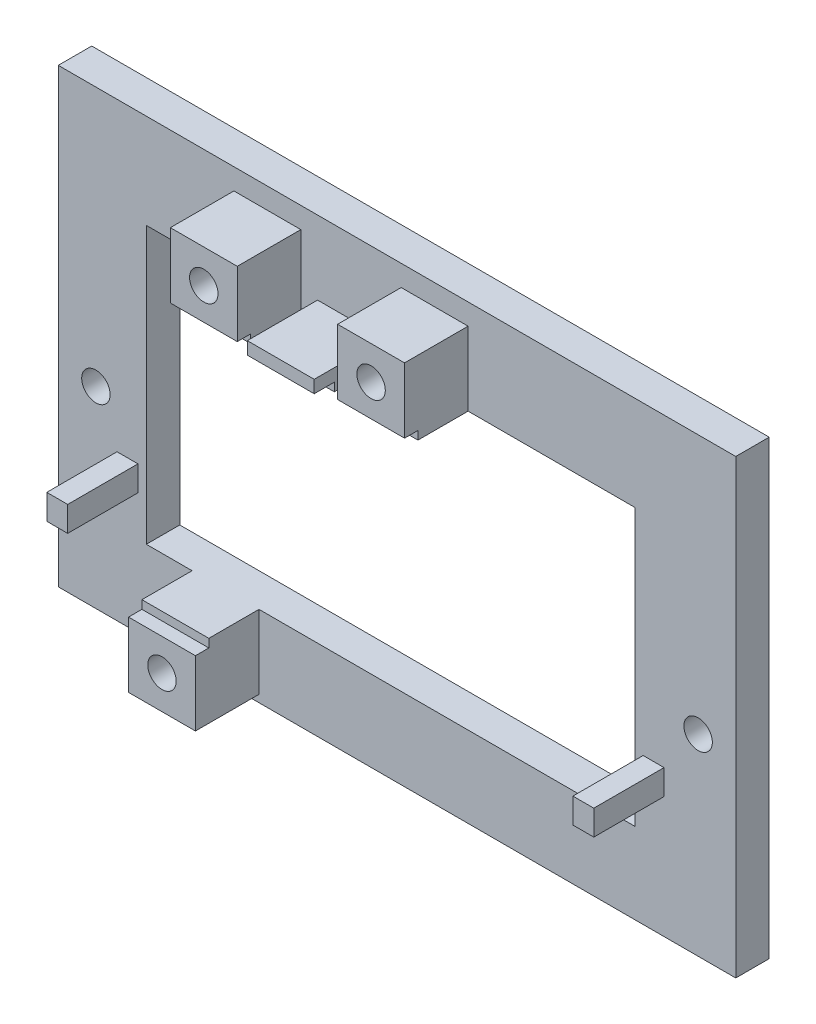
SolidWorks part; units mm, degrees
ref_plane "前视基准面" through (0, 0, 0) normal (0, 0, 1) x (1, 0, 0)
ref_plane "上视基准面" through (0, 0, 0) normal (0, 1, 0) x (1, 0, 0)
ref_plane "右视基准面" through (0, 0, 0) normal (1, 0, 0) x (0, 0, -1)
other "Configuration Table"
sketch "草图1" plane through (0, 0, 0) normal (0, 0, 1) x (1, 0, 0)
  line L0 (-35, -19) -> (46, -19)
  line L1 (46, -19) -> (46, 35)
  line L2 (46, 35) -> (-35, 35)
  line L3 (-35, 35) -> (-35, -19)
  line L4 (-24.473, -9.328) -> (33.927, -9.328)
  line L5 (33.927, -9.328) -> (33.927, 23.691)
  line L6 (33.927, 23.691) -> (-24.473, 23.691)
  line L7 (-24.473, 23.691) -> (-24.473, -9.328)
  circle A0 centre (-30.5, 4) radius 1.7
  circle A1 centre (41.5, 4) radius 1.7
  circle A2 centre (-10, 28.491) radius 1.7
  circle A3 centre (10, 28.491) radius 1.7
  circle A4 centre (-15, -14.128) radius 1.7
  dimension "D1" = 3.4
  dimension "D2" = 10
  dimension "D3" = 33.927
  dimension "D4" = 41.5
  dimension "D5" = 46
  dimension "D6" = 10
  dimension "D7" = 15
  dimension "D8" = 24.473
  dimension "D9" = 30.5
  dimension "D10" = 35
  dimension "D11" = 4
  dimension "D12" = 23.691
  dimension "D13" = 28.491
  dimension "D14" = 35
  dimension "D15" = 9.328
  dimension "D16" = 14.128
  dimension "D17" = 19
extrude "Open_back_tray_and_M3_holes" add sketch "草图1" along normal blind 4
sketch "草图2" plane through (0, 0, 0) normal (0, 0, 1) x (1, 0, 0)
  line L0 (-14, 23.691) -> (-6, 23.691)
  line L1 (-6, 23.691) -> (-6, 32.491)
  line L2 (-6, 32.491) -> (-14, 32.491)
  line L3 (-14, 32.491) -> (-14, 23.691)
  line L4 (6, 23.691) -> (14, 23.691)
  line L5 (14, 23.691) -> (14, 32.491)
  line L6 (14, 32.491) -> (6, 32.491)
  line L7 (6, 32.491) -> (6, 23.691)
  line L8 (-4, 23.691) -> (4, 23.691)
  line L9 (4, 23.691) -> (4, 26.191)
  line L10 (4, 26.191) -> (-4, 26.191)
  line L11 (-4, 26.191) -> (-4, 23.691)
  line L12 (-19, -18.128) -> (-11, -18.128)
  line L13 (-11, -18.128) -> (-11, -9.328)
  line L14 (-11, -9.328) -> (-19, -9.328)
  line L15 (-19, -9.328) -> (-19, -18.128)
  circle A0 centre (-10, 28.491) radius 1.7
  circle A1 centre (10, 28.491) radius 1.7
  circle A2 centre (-15, -14.128) radius 1.7
  dimension "D1" = 3.4
  dimension "D2" = 4
  dimension "D3" = 6
  dimension "D4" = 10
  dimension "D5" = 14
  dimension "D6" = 6
  dimension "D7" = 11
  dimension "D8" = 10
  dimension "D9" = 15
  dimension "D10" = 23.691
  dimension "D11" = 26.191
  dimension "D12" = 28.491
  dimension "D13" = 32.491
  dimension "D14" = 9.328
  dimension "D15" = 14.128
extrude "Board_edge_shelves" add sketch "草图2" along normal blind 6 from offset 4
sketch "草图3" plane through (0, 0, 0) normal (0, 0, 1) x (1, 0, 0)
  line L0 (-14, 24.691) -> (-6, 24.691)
  line L1 (-6, 24.691) -> (-6, 32.491)
  line L2 (-6, 32.491) -> (-14, 32.491)
  line L3 (-14, 32.491) -> (-14, 24.691)
  line L4 (6, 24.691) -> (14, 24.691)
  line L5 (14, 24.691) -> (14, 32.491)
  line L6 (14, 32.491) -> (6, 32.491)
  line L7 (6, 32.491) -> (6, 24.691)
  line L8 (-19, -18.128) -> (-11, -18.128)
  line L9 (-11, -18.128) -> (-11, -10.328)
  line L10 (-11, -10.328) -> (-19, -10.328)
  line L11 (-19, -10.328) -> (-19, -18.128)
  circle A0 centre (-10, 28.491) radius 1.7
  circle A1 centre (10, 28.491) radius 1.7
  circle A2 centre (-15, -14.128) radius 1.7
  dimension "D1" = 3.4
  dimension "D2" = 6
  dimension "D3" = 10
  dimension "D4" = 14
  dimension "D5" = 6
  dimension "D6" = 10
  dimension "D7" = 11
  dimension "D8" = 15
  dimension "D9" = 24.691
  dimension "D10" = 28.491
  dimension "D11" = 32.491
  dimension "D12" = 10.328
  dimension "D13" = 14.128
extrude "Outside_clip_bosses" add sketch "草图3" along normal blind 1.6 from offset 10
sketch "草图4" plane through (0, 0, 0) normal (0, 0, 1) x (1, 0, 0)
  line L0 (-4, 24.691) -> (4, 24.691)
  line L1 (4, 24.691) -> (4, 26.191)
  line L2 (4, 26.191) -> (-4, 26.191)
  line L3 (-4, 26.191) -> (-4, 24.691)
  dimension "D1" = 4
  dimension "D2" = 4
  dimension "D3" = 24.691
  dimension "D4" = 26.191
extrude "Lower_edge_gravity_stop" add sketch "草图4" along normal blind 2.4 from offset 10
sketch "草图5" plane through (0, 0, 0) normal (0, 0, 1) x (1, 0, 0)
  line L0 (-27.973, -4.5) -> (-25.473, -4.5)
  line L1 (-25.473, -4.5) -> (-25.473, -1.5)
  line L2 (-25.473, -1.5) -> (-27.973, -1.5)
  line L3 (-27.973, -1.5) -> (-27.973, -4.5)
  line L4 (34.927, -4.5) -> (37.427, -4.5)
  line L5 (37.427, -4.5) -> (37.427, -1.5)
  line L6 (37.427, -1.5) -> (34.927, -1.5)
  line L7 (34.927, -1.5) -> (34.927, -4.5)
  dimension "D1" = 34.927
  dimension "D2" = 37.427
  dimension "D3" = 25.473
  dimension "D4" = 1.5
  dimension "D5" = 4.5
extrude "Fixed_left_right_edge_stops" add sketch "草图5" along normal blind 8.4 from offset 4
